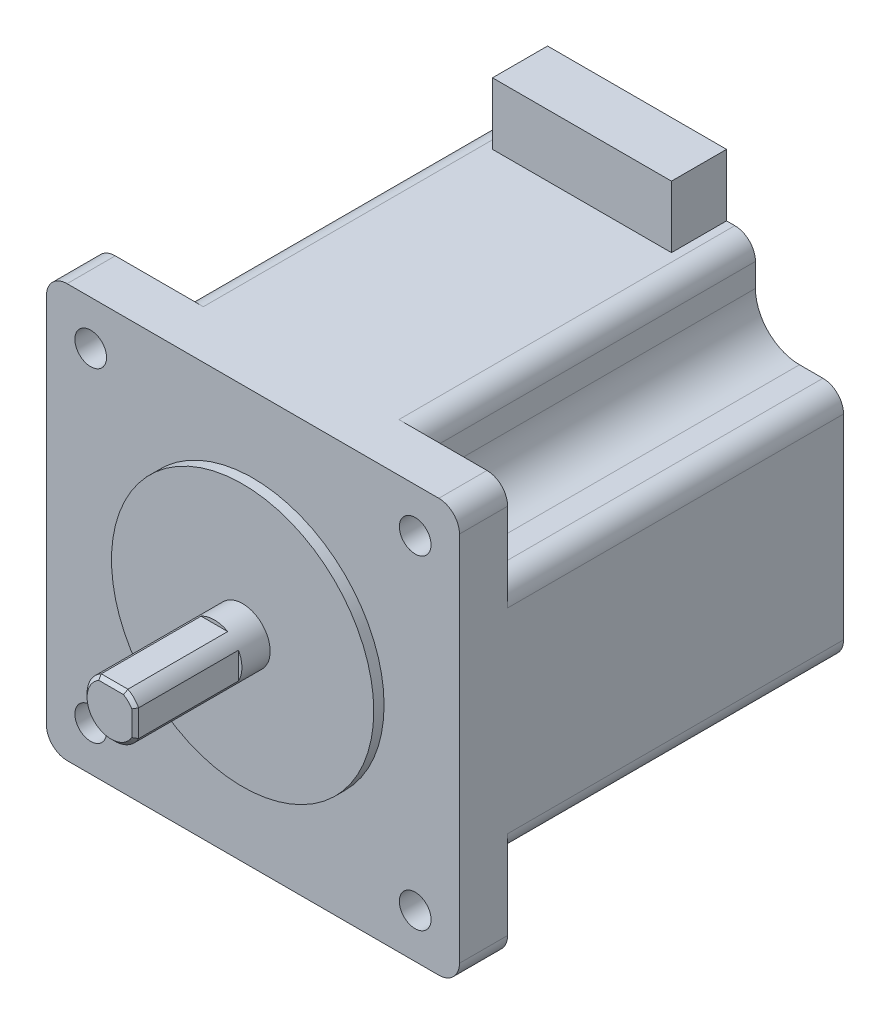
SolidWorks part; units mm, degrees
ref_plane "前视基准面" through (0, 0, 0) normal (0, 0, 1) x (1, 0, 0)
ref_plane "上视基准面" through (0, 0, 0) normal (0, 1, 0) x (1, 0, 0)
ref_plane "右视基准面" through (0, 0, 0) normal (1, 0, 0) x (0, 0, -1)
sketch "草图1" plane through (0, 0, 0) normal (0, 0, 1) x (1, 0, 0)
  circle A0 centre (0, 0) radius 19.05
extrude "凸台-拉伸1" add sketch "草图1" against normal blind 1.5
sketch "草图2" plane through (0, 0, 0) normal (0, 0, 1) x (1, 0, 0)
  circle A0 centre (0, 0) radius 4
extrude "凸台-拉伸2" add sketch "草图2" along normal blind 19.1
sketch "草图3" plane through (0, 0, 19.1) normal (0, 0, 1) x (1, 0, 0)
  line L0 (3.5, 0) -> (3.5, -4)
  line L1 (0, 3.5) -> (3, 3.5)
  line L2 (3, 3.5) -> (3, 6.1575)
  line L3 (3, 6.1575) -> (-4, 6.1575)
  line L4 (-4, 6.1575) -> (-4, 3.5)
  line L5 (-4, 3.5) -> (0, 3.5)
  line L7 (3.5, -4) -> (7.6659, -4)
  line L8 (7.6659, -4) -> (7.6659, 3.5)
  line L9 (7.6659, 3.5) -> (3.5, 3.5)
  line L10 (3.5, 3.5) -> (3.5, 0)
extrude "切除-拉伸1" cut sketch "草图3" against normal blind 15
chamfer "倒角1" distance 0.5 angle 45 4 edges at (0, 3.5, 19.1) (2.8284, 2.8284, 19.1) (-2.8284, -2.8284, 19.1) (3.5, 0, 19.1)
sketch "草图4" plane through (0, 0, -1.5) normal (0, 0, -1) x (-1, 0, 0)
  line L1 (0, 30) -> (27, 30)
  line L2 (30, 27) -> (30, -27)
  line L3 (27, -30) -> (-27, -30)
  line L4 (-30, -27) -> (-30, 27)
  line L5 (-27, 30) -> (0, 30)
  arc A0 (-27, -30) -> (-30, -27) centre (-27, -27) cw
  arc A1 (30, -27) -> (27, -30) centre (27, -27) cw
  arc A2 (27, 30) -> (30, 27) centre (27, 27) cw
  arc A3 (-30, 27) -> (-27, 30) centre (-27, 27) cw
  circle A4 centre (23.57, 23.57) radius 2.3
  circle A5 centre (23.57, -23.57) radius 2.3
  circle A6 centre (-23.57, -23.57) radius 2.3
  circle A7 centre (-23.57, 23.57) radius 2.3
  dimension "D1" = 3
extrude "凸台-拉伸3" add sketch "草图4" along normal blind 55.8
sketch "草图5" plane through (0, 0, -57.3) normal (0, 0, -1) x (-1, 0, 0)
  line L1 (27, 30) -> (-27, 30) construction
  line L2 (10.2835, 30) -> (14.2, 30)
  line L3 (17.2, 27) -> (17.2, 23.6)
  line L4 (23.6, 17.2) -> (27, 17.2)
  line L5 (-10.2835, 39.1307) -> (-10.2835, 30)
  line L6 (30, -27) -> (30, 27) construction
  line L7 (30, 14.2) -> (30, 9.8667)
  line L8 (30, 9.8667) -> (35.4123, 9.8667)
  line L9 (35.4123, 9.8667) -> (35.4123, 39.1307)
  line L10 (35.4123, 39.1307) -> (10.2835, 39.1307)
  line L11 (10.2835, 39.1307) -> (10.2835, 30)
  line L13 (-35.4123, 39.1307) -> (-10.2835, 39.1307)
  line L14 (-35.4123, 9.8667) -> (-35.4123, 39.1307)
  line L15 (-30, 9.8667) -> (-35.4123, 9.8667)
  line L16 (-30, 14.2) -> (-30, 9.8667)
  line L17 (-23.6, 17.2) -> (-27, 17.2)
  line L18 (-17.2, 27) -> (-17.2, 23.6)
  line L19 (-10.2835, 30) -> (-14.2, 30)
  line L20 (10.2835, -39.1307) -> (10.2835, -30)
  line L21 (35.4123, -39.1307) -> (10.2835, -39.1307)
  line L22 (35.4123, -9.8667) -> (35.4123, -39.1307)
  line L23 (30, -9.8667) -> (35.4123, -9.8667)
  line L24 (30, -14.2) -> (30, -9.8667)
  line L25 (23.6, -17.2) -> (27, -17.2)
  line L26 (17.2, -27) -> (17.2, -23.6)
  line L27 (10.2835, -30) -> (14.2, -30)
  line L28 (-10.2835, -30) -> (-14.2, -30)
  line L29 (-17.2, -27) -> (-17.2, -23.6)
  line L30 (-23.6, -17.2) -> (-27, -17.2)
  line L31 (-30, -14.2) -> (-30, -9.8667)
  line L32 (-30, -9.8667) -> (-35.4123, -9.8667)
  line L33 (-35.4123, -9.8667) -> (-35.4123, -39.1307)
  line L34 (-35.4123, -39.1307) -> (-10.2835, -39.1307)
  line L35 (-10.2835, -39.1307) -> (-10.2835, -30)
  arc A0 (17.2, 23.6) -> (23.6, 17.2) centre (23.6, 23.6) ccw
  arc A1 (27, 17.2) -> (30, 14.2) centre (27, 14.2) cw
  arc A2 (14.2, 30) -> (17.2, 27) centre (14.2, 27) cw
  arc A3 (-14.2, 30) -> (-17.2, 27) centre (-14.2, 27) ccw
  arc A4 (-27, 17.2) -> (-30, 14.2) centre (-27, 14.2) ccw
  arc A5 (-17.2, 23.6) -> (-23.6, 17.2) centre (-23.6, 23.6) cw
  arc A6 (14.2, -30) -> (17.2, -27) centre (14.2, -27) ccw
  arc A7 (27, -17.2) -> (30, -14.2) centre (27, -14.2) ccw
  arc A8 (17.2, -23.6) -> (23.6, -17.2) centre (23.6, -23.6) cw
  arc A9 (-17.2, -23.6) -> (-23.6, -17.2) centre (-23.6, -23.6) ccw
  arc A10 (-27, -17.2) -> (-30, -14.2) centre (-27, -14.2) cw
  arc A11 (-14.2, -30) -> (-17.2, -27) centre (-14.2, -27) cw
  point P20 (30, 17.2)
  point P23 (17.2, 30)
  point P38 (-17.2, 30)
  point P39 (-30, 17.2)
  point P54 (17.2, -30)
  point P55 (30, -17.2)
  point P70 (-30, -17.2)
  point P71 (-17.2, -30)
  dimension "D1" = 6.4
  dimension "D2" = 3
extrude "切除-拉伸2" cut sketch "草图5" against normal blind 48.8
sketch "草图6" plane through (0, 0, -57.3) normal (0, 0, -1) x (-1, 0, 0)
  line L0 (0, 30) -> (13, 30)
  line L1 (14.2, 30) -> (-14.2, 30) construction
  line L2 (13, 30) -> (13, 39)
  line L3 (13, 39) -> (-13, 39)
  line L4 (-13, 39) -> (-13, 30)
  line L5 (-13, 30) -> (0, 30)
extrude "凸台-拉伸4" add sketch "草图6" against normal blind 8 separate body
